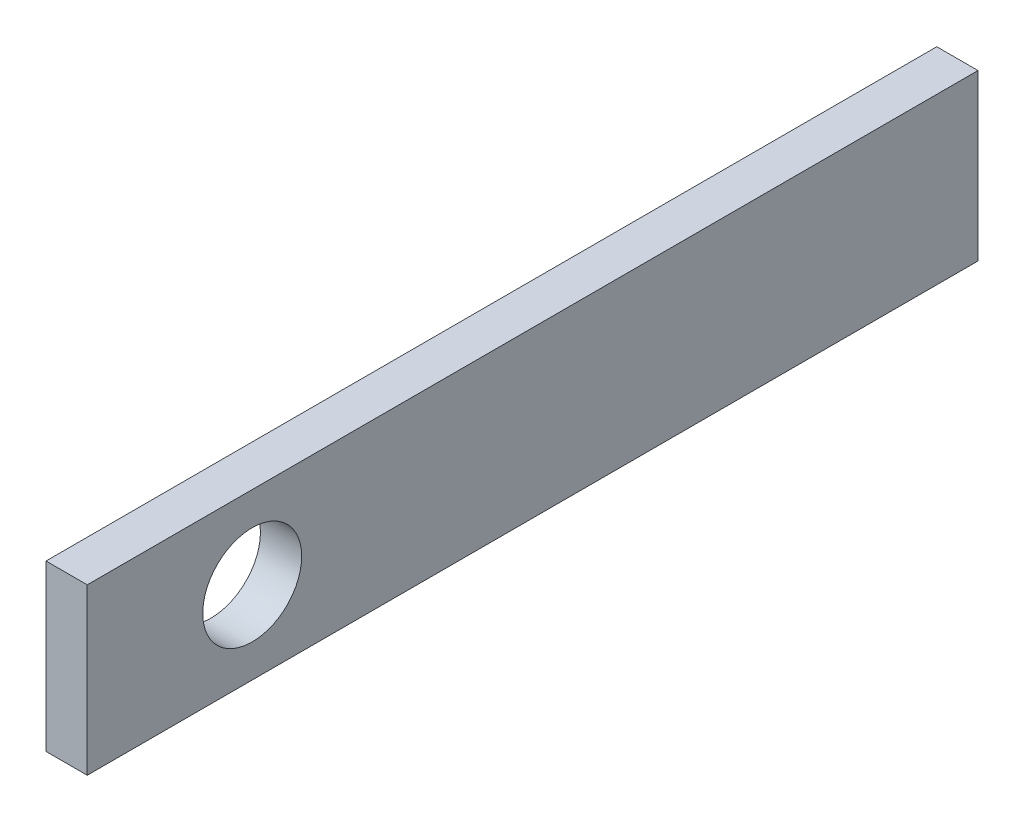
SolidWorks part; units mm, degrees
ref_plane "Front Plane" through (0, 0, 0) normal (0, 0, 1) x (1, 0, 0)
ref_plane "Top Plane" through (0, 0, 0) normal (0, 1, 0) x (1, 0, 0)
ref_plane "Right Plane" through (0, 0, 0) normal (1, 0, 0) x (0, 0, -1)
sketch "Sketch1" plane through (0, 0, 0) normal (1, 0, 0) x (0, 0, -1)
  line L1 (0, 0) -> (68.58, 0)
  line L2 (0, 0) -> (0, 12.7)
  line L3 (0, 12.7) -> (68.58, 12.7)
  line L4 (68.58, 0) -> (68.58, 12.7)
  circle A0 centre (12.7, 6.35) radius 3.81
  point P8 (0, 6.35)
  dimension "D1" = 7.62
  dimension "D2" = 12.7
  dimension "D5" = 12.7
  dimension "2.25" = 68.58
extrude "Boss-Extrude1" add sketch "Sketch1" along normal blind 3.175
hole_wizard "#4 Clearance Hole1" positions "Sketch3" profile "Sketch2" hole size "#4" standard "ANSI Inch"
sketch "Sketch3" plane through (3.175, 0, 0) normal (1, 0, 0) x (0, 0, -1)
  circle A0 centre (12.7, 6.35) radius 3.81 construction
  point P0 (55.88, 6.35)
  point P5 (48.768, 6.35)
  dimension "D1" = 43.18
  dimension "D2" = 7.112
sketch "Sketch2" plane through (3.175, 6.35, -55.88) normal (0, 1, 0) x (0, 0, -1)
  line L0 (0, 0) -> (0, 3.175)
  line L1 (0, 3.175) -> (1.4732, 3.175)
  line L2 (1.4732, 3.175) -> (1.4732, 0)
  line L5 (1.4732, 0) -> (0, 0)
  line L11 (0, -6.35) -> (0, 107.95) construction
  dimension "Thru Hole Dia." = 2.9464
  dimension "Thru Hole Depth" = 3.175
sketch "Sketch4" plane through (3.175, 0, 0) normal (1, 0, 0) x (0, 0, -1)
  line L1 (59.5462, 6.35) -> (57.7131, 9.525)
  line L2 (57.7131, 9.525) -> (54.0469, 9.525)
  line L3 (54.0469, 9.525) -> (52.2138, 6.35)
  line L4 (52.2138, 6.35) -> (54.0469, 3.175)
  line L5 (54.0469, 3.175) -> (57.7131, 3.175)
  line L6 (57.7131, 3.175) -> (59.5462, 6.35)
  circle A0 centre (55.88, 6.35) radius 3.175 construction
  dimension "D1" = 6.35
extrude "Cut-Extrude1" [suppressed] cut sketch "Sketch4" against normal through all
